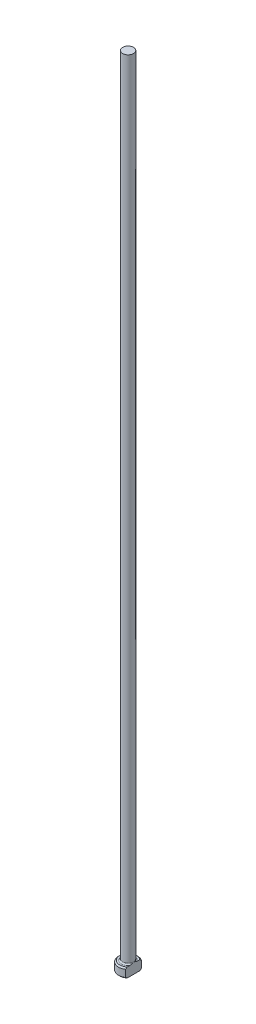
SolidWorks part; units mm, degrees
ref_plane "Front Plane" through (0, 0, 0) normal (0, 0, 1) x (1, 0, 0)
ref_plane "Top Plane" through (0, 0, 0) normal (0, 1, 0) x (1, 0, 0)
ref_plane "Right Plane" through (0, 0, 0) normal (1, 0, 0) x (0, 0, -1)
sketch "Sketch1" plane through (0, 0, 0) normal (0, 0, 1) x (1, 0, 0)
  line L0 (0, 259.9588) -> (0, -15.1925) construction
  line L1 (0, 0) -> (-1.5, 0)
  line L2 (-1.5, 0) -> (-1.5, 1.5)
  line L3 (-1.5, 1.5) -> (-0.85, 1.5)
  line L4 (-0.85, 1.5) -> (-0.85, 125)
  line L5 (-0.85, 125) -> (0, 125)
  line L6 (0, 125) -> (0, 0)
  dimension "L" = 125
  dimension "H" = 3
  dimension "T" = 1.5
  dimension "D" = 1.7
revolve "Revolve1" add sketch "Sketch1" angle 360 about L0
chamfer "Chamfer1" distance 0.2 angle 45 2 edges at (0, 1.5, 1.5) (0, 0, 1.5)
fillet "Fillet1" radius 0.2 1 edges at (0, 1.5, 0.85)
sketch "Sketch2" plane through (0, 0, 0) normal (0, 1, 0) x (1, 0, 0)
  line L0 (0.85, 1.2359) -> (0.85, -1.2359)
  circle A0 centre (0, 0) radius 1.5 construction
  arc A1 (0.85, -1.2359) -> (0.85, 1.2359) centre (0, 0) ccw
  circle A2 centre (0, 0) radius 0.85 construction
extrude "KEY" cut sketch "Sketch2" along normal through all
